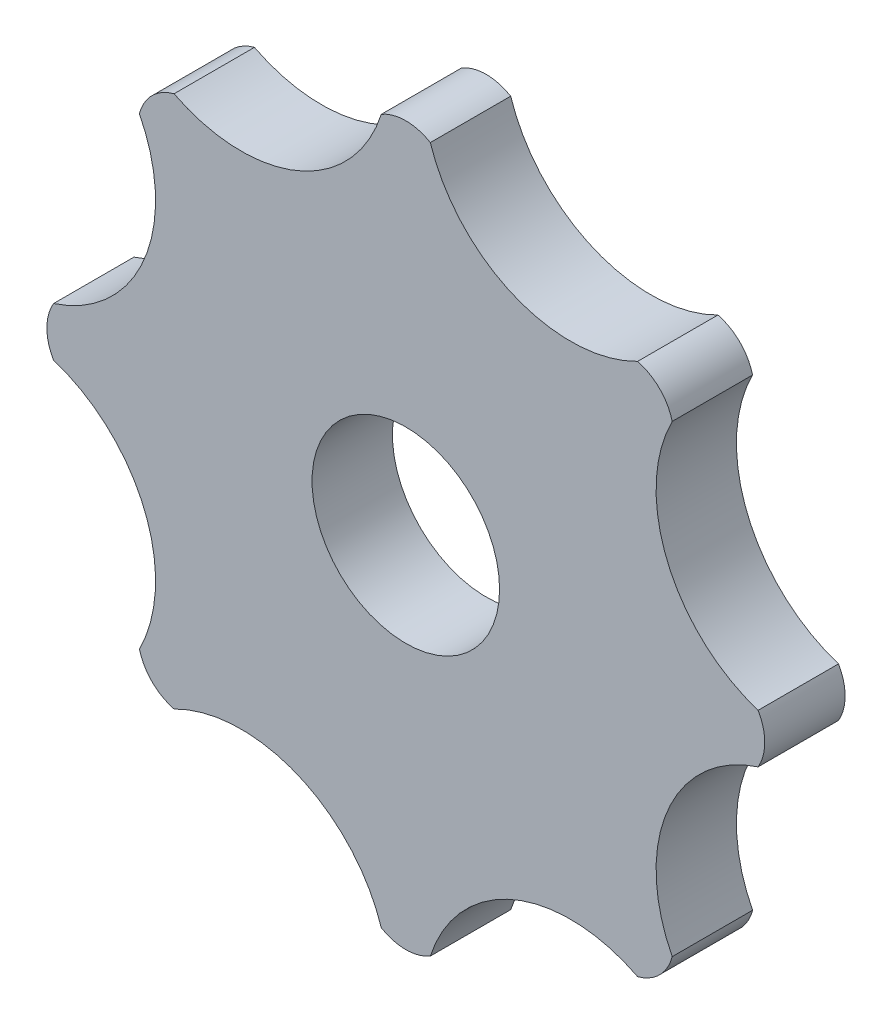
SolidWorks part; units mm, degrees
ref_plane "Plan1" through (0, 0, 0) normal (0, 0, 1) x (1, 0, 0)
ref_plane "Plan2" through (0, 0, 0) normal (0, 1, 0) x (1, 0, 0)
ref_plane "Plan3" through (0, 0, 0) normal (1, 0, 0) x (0, 0, -1)
sketch "Esquisse1" plane through (0, 0, 0) normal (0, 0, 1) x (1, 0, 0)
  line L0 (0, 0) -> (24.0566, 0) construction
  line L1 (0, 0) -> (16.1003, 16.1003) construction
  line L2 (0, 0) -> (29.4831, 12.2123) construction
  arc A0 (9.9454, 8.6521) -> (9.4752, 9.4752) centre (8.2024, 8.2024) ccw
  arc A1 (13.4, 0) -> (13.1504, 0.9144) centre (11.6, 0) ccw
  arc A2 (9.9454, 8.6521) -> (13.1504, 0.9144) centre (14.8421, 6.1478) ccw
  arc A3 (13.1504, -0.9144) -> (9.9454, -8.6521) centre (14.8421, -6.1478) ccw
  arc A4 (13.1504, -0.9144) -> (13.4, 0) centre (11.6, 0) ccw
  arc A5 (9.4752, -9.4752) -> (9.9454, -8.6521) centre (8.2024, -8.2024) ccw
  arc A6 (8.6521, -9.9454) -> (0.9144, -13.1504) centre (6.1478, -14.8421) ccw
  arc A7 (8.6521, -9.9454) -> (9.4752, -9.4752) centre (8.2024, -8.2024) ccw
  arc A8 (0, -13.4) -> (0.9144, -13.1504) centre (0, -11.6) ccw
  arc A9 (-0.9144, -13.1504) -> (-8.6521, -9.9454) centre (-6.1478, -14.8421) ccw
  arc A10 (-0.9144, -13.1504) -> (0, -13.4) centre (0, -11.6) ccw
  arc A11 (-9.4752, -9.4752) -> (-8.6521, -9.9454) centre (-8.2024, -8.2024) ccw
  arc A12 (-9.9454, -8.6521) -> (-13.1504, -0.9144) centre (-14.8421, -6.1478) ccw
  arc A13 (-9.9454, -8.6521) -> (-9.4752, -9.4752) centre (-8.2024, -8.2024) ccw
  arc A14 (-13.4, 0) -> (-13.1504, -0.9144) centre (-11.6, 0) ccw
  arc A15 (-13.1504, 0.9144) -> (-9.9454, 8.6521) centre (-14.8421, 6.1478) ccw
  arc A16 (-13.1504, 0.9144) -> (-13.4, 0) centre (-11.6, 0) ccw
  arc A17 (-9.4752, 9.4752) -> (-9.9454, 8.6521) centre (-8.2024, 8.2024) ccw
  arc A18 (-8.6521, 9.9454) -> (-0.9144, 13.1504) centre (-6.1478, 14.8421) ccw
  arc A19 (-8.6521, 9.9454) -> (-9.4752, 9.4752) centre (-8.2024, 8.2024) ccw
  arc A20 (0, 13.4) -> (-0.9144, 13.1504) centre (0, 11.6) ccw
  arc A21 (0.9144, 13.1504) -> (8.6521, 9.9454) centre (6.1478, 14.8421) ccw
  arc A22 (0.9144, 13.1504) -> (0, 13.4) centre (0, 11.6) ccw
  arc A23 (9.4752, 9.4752) -> (8.6521, 9.9454) centre (8.2024, 8.2024) ccw
  dimension "D1" = 11.6
  dimension "D2" = 11.6
  dimension "D3" = 3.6
  dimension "D4" = 11
  dimension "D5" = 45
  dimension "D6" = 22.5
  dimension "D7" = 16.065
extrude "Base-Extrusion" add sketch "Esquisse1" along normal blind 3
sketch "Esquisse2" plane through (0, 0, 3) normal (0, 0, 1) x (1, 0, 0)
  circle A0 centre (0, 0) radius 3.5
  dimension "D1" = 7
extrude "Enlèv. mat.-Extru.1" cut sketch "Esquisse2" against normal through all
sketch "Esquisse3" plane through (0, 0, 3) normal (0, 0, 1) x (1, 0, 0)
  line L0 (0, 0) -> (4.5131, -3.1703)
